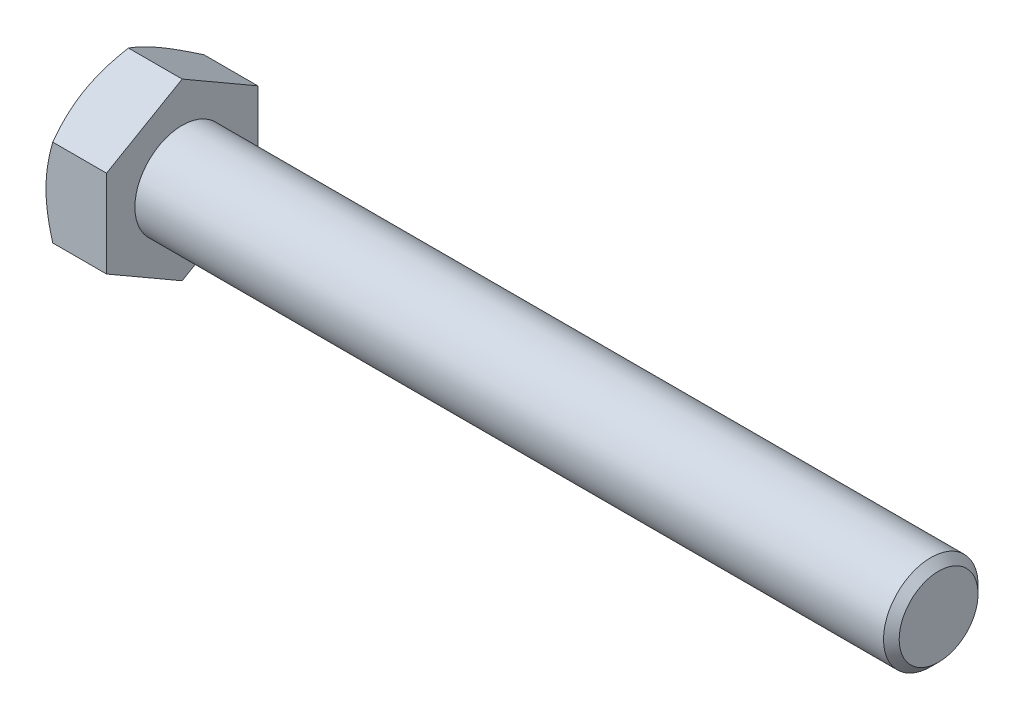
SolidWorks part; units mm, degrees
ref_plane "Front Plane" through (0, 0, 0) normal (0, 0, 1) x (1, 0, 0)
ref_plane "Top Plane" through (0, 0, 0) normal (0, 1, 0) x (1, 0, 0)
ref_plane "Right Plane" through (0, 0, 0) normal (1, 0, 0) x (0, 0, -1)
sketch "BaseHeadSke" plane through (0, 0, 0) normal (1, 0, 0) x (0, 0, -1)
  line L1 (0, 9.2376) -> (-8, 4.6188)
  line L2 (-8, 4.6188) -> (-8, -4.6188)
  line L3 (-8, -4.6188) -> (0, -9.2376)
  line L4 (0, -9.2376) -> (8, -4.6188)
  line L5 (8, -4.6188) -> (8, 4.6188)
  line L6 (8, 4.6188) -> (0, 9.2376)
  circle A0 centre (0, 0) radius 8 construction
  dimension "Width_flats" = 16
extrude "BaseHead" add sketch "BaseHeadSke" along normal blind 6.4
sketch "HeadChamferSke" plane through (0, 0, 0) normal (0, 0, 1) x (1, 0, 0)
  line L0 (0, 0) -> (17.6355, 0) construction
  line L1 (0, 4.6188) -> (0, -4.6188) construction
  line L2 (0, 9.2376) -> (0, 8)
  line L3 (0, 8) -> (0.7145, 9.2376)
  line L4 (0.7145, 9.2376) -> (0, 9.2376)
  line L7 (6.4, 9.2376) -> (0, 9.2376) construction
  dimension "Angle_Chamfer_Head" = 30
revolve "HeadChamfer" cut sketch "HeadChamferSke" angle 360 about L0
sketch "BodySke" plane through (0, 0, 0) normal (0, 0, 1) x (1, 0, 0)
  line L0 (0, 0) -> (92.9385, 0) construction
  line L1 (0, 0) -> (0, 5)
  line L2 (0, 5) -> (85.572, 5)
  line L3 (85.572, 5) -> (86.4, 4.172)
  line L4 (86.4, 4.172) -> (86.4, 0)
  line L5 (86.4, 0) -> (0, 0)
  line L6 (6.4, 4.6188) -> (6.4, -4.6188) construction
  line L7 (7.9, 0) -> (7.9, 8.0817) construction
  dimension "Thread_minor" = 8.344
  dimension "Diameter" = 10
  dimension "Length" = 80
  dimension "Body_Chamfer_Angle" = 45
  dimension "Advance" = 1.5
revolve "BaseBody" add sketch "BodySke" angle 360 about L0
sketch "BearingFaceSke" plane through (0, 0, 0) normal (0, 0, 1) x (1, 0, 0)
  line L0 (0, 0) -> (95.3653, 0) construction
  line L1 (6.4, 9.2376) -> (6.4, 4.6188) construction
  line L2 (6.4, 8) -> (5.8, 8)
  line L3 (6.4, 8) -> (6.4, 18)
  line L4 (6.4, 18) -> (5.8, 18)
  line L5 (5.8, 8) -> (5.8, 18)
  dimension "D1" = 10
  dimension "D2" = 16
  dimension "Bearing_height" = 0.6
revolve "BearingFace" [suppressed] cut sketch "BearingFaceSke" angle 360 about L0
fillet "HeadFillet" [suppressed] radius 0.4
sketch "ThdSchSke" plane through (0, 0, 0) normal (0, 0, 1) x (1, 0, 0)
  line L0 (0, 0) -> (95.762, 0) construction
  line L1 (84.072, 5.9561) -> (84.072, 5)
  line L2 (84.072, 5.9561) -> (85.0281, 5.9561)
  line L3 (85.0281, 5.9561) -> (85.0281, 5)
  line L4 (85.0281, 5) -> (84.55, 4.172)
  line L5 (84.55, 4.172) -> (84.072, 5)
  dimension "D1" = 1.5
revolve "ThreadSchematic" [suppressed] cut sketch "ThdSchSke" angle 360 about L0
pattern_linear "ThdSchPat" [suppressed]
equation "\"Thread_minor@ThreadCosmetic\" = \"Thread_minor@BodySke\""
equation "\"D2@BearingFaceSke\" = \"Width_flats@BaseHeadSke\""
equation "\"D1@ThdSchSke\" = \"Advance@BodySke\""
equation "\"Advance@ThdSchPat\" = \"Advance@BodySke\""
equation "\"Tooth_Num@ThdSchPat\" =  int( \"Length@BodySke\" / \"Advance@BodySke\" ) - 1 "
